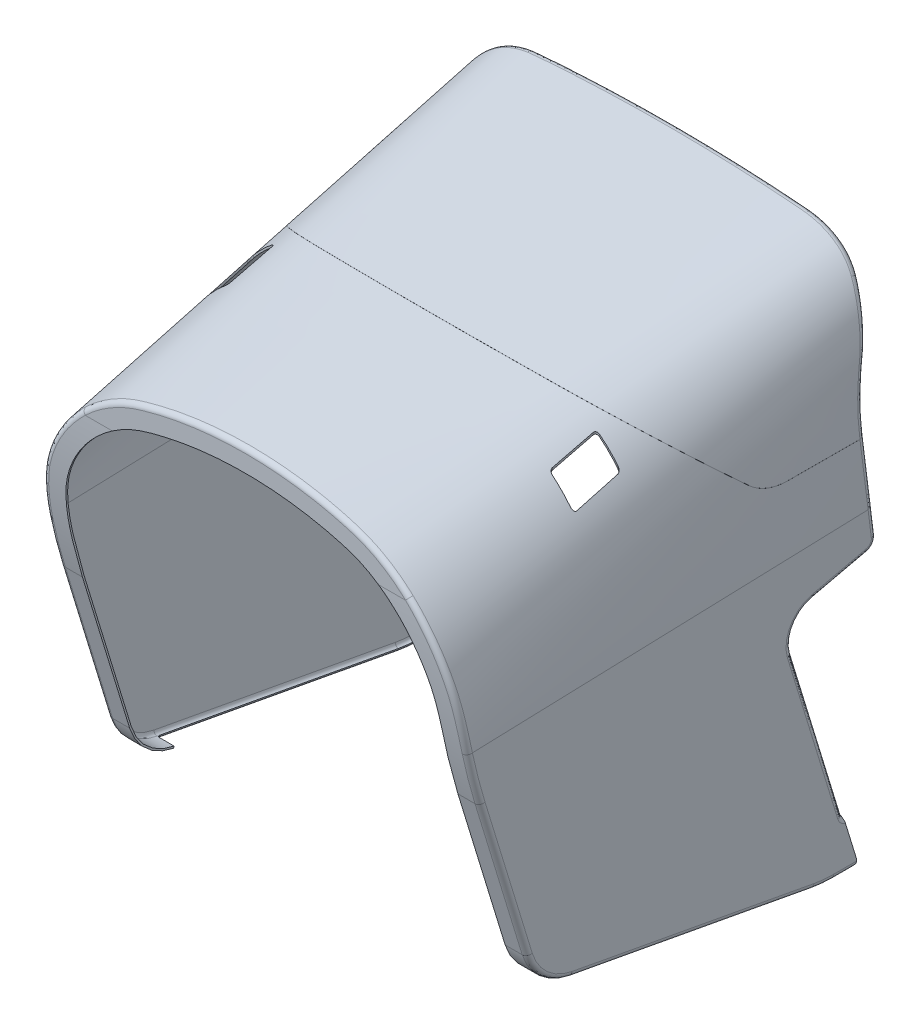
SolidWorks part; units mm, degrees
ref_plane "Plan de face" through (0, 0, 0) normal (0, 0, 1) x (1, 0, 0)
ref_plane "Plan de dessus" through (0, 0, 0) normal (0, 1, 0) x (1, 0, 0)
ref_plane "Plan de droite" through (0, 0, 0) normal (1, 0, 0) x (0, 0, -1)
imported_body "Stock-SEVPRO-5e-1"
imported_body "Stock-SEVPRO-5e-2"
sketch "Esquisse1" plane through (0, 0, 0) normal (0, 1, 0) x (1, 0, 0)
  line L0 (-281.4447, -285) -> (281.4447, -285) construction
  line L1 (320, 49.5) -> (288, 49.5)
  line L2 (325.5, 44) -> (325.5, -28)
  line L3 (320, -33.5) -> (288, -33.5)
  line L4 (282.5, 44) -> (282.5, -28)
  line L5 (0, 0) -> (0, 290.3921) construction
  line L6 (-282.5, 44) -> (-282.5, -28)
  line L7 (-320, -33.5) -> (-288, -33.5)
  line L8 (-325.5, 44) -> (-325.5, -28)
  line L9 (-320, 49.5) -> (-288, 49.5)
  arc A0 (288, -33.5) -> (282.5, -28) centre (288, -28) cw
  arc A1 (325.5, -28) -> (320, -33.5) centre (320, -28) cw
  arc A2 (320, 49.5) -> (325.5, 44) centre (320, 44) cw
  arc A3 (288, 49.5) -> (282.5, 44) centre (288, 44) ccw
  arc A4 (-288, 49.5) -> (-282.5, 44) centre (-288, 44) cw
  arc A5 (-320, 49.5) -> (-325.5, 44) centre (-320, 44) ccw
  arc A6 (-325.5, -28) -> (-320, -33.5) centre (-320, -28) ccw
  arc A7 (-288, -33.5) -> (-282.5, -28) centre (-288, -28) ccw
  point P13 (325.5, -33.5)
  point P16 (325.5, 49.5)
  point P19 (282.5, 49.5)
  point P32 (-282.5, 49.5)
  point P33 (-325.5, 49.5)
  point P34 (-325.5, -33.5)
  dimension "D5" = 5.5
  dimension "D1" = 251.5
  dimension "D2" = 325.5
  dimension "D3" = 43
  dimension "D4" = 83
extrude "Enlèv. mat.-Extru.1" cut sketch "Esquisse1" along normal blind 1000
